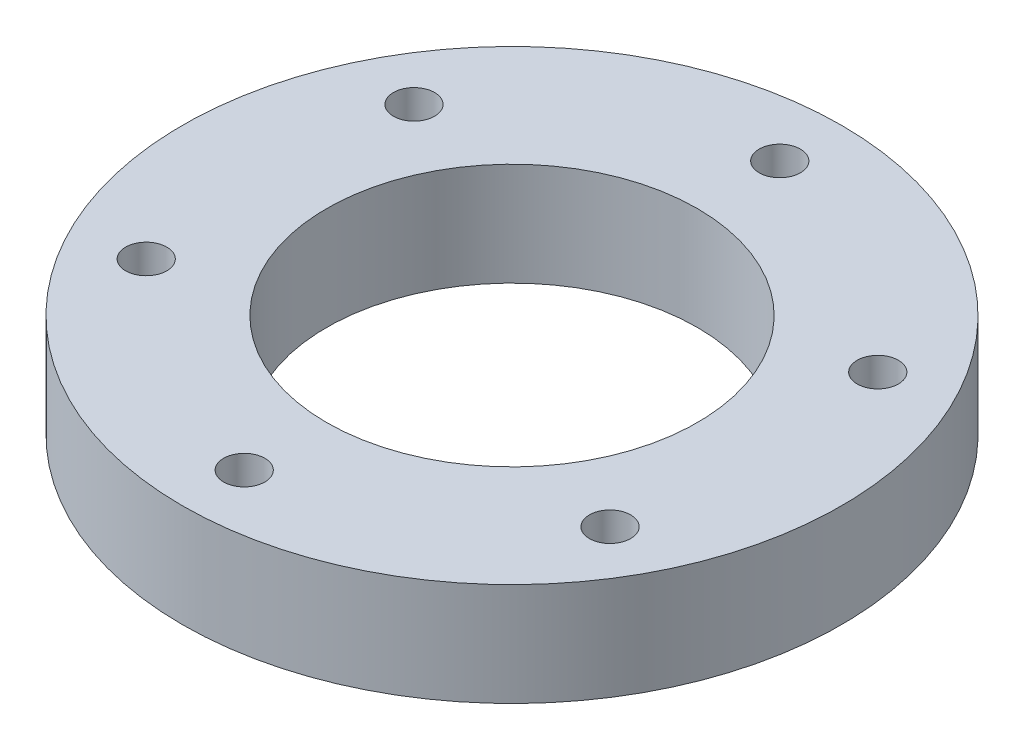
SolidWorks part; units mm, degrees
ref_plane "Front Plane" through (0, 0, 0) normal (0, 0, 1) x (1, 0, 0)
ref_plane "Top Plane" through (0, 0, 0) normal (0, 1, 0) x (1, 0, 0)
ref_plane "Right Plane" through (0, 0, 0) normal (1, 0, 0) x (0, 0, -1)
sketch "Sketch1" plane through (0, 0, 0) normal (0, 1, 0) x (1, 0, 0)
  circle A0 centre (0, 0) radius 11.43
  circle A1 centre (0, 0) radius 20.32
  circle A2 centre (0, 16.51) radius 1.27
  circle A3 centre (14.2981, 8.255) radius 1.27
  circle A4 centre (14.2981, -8.255) radius 1.27
  circle A5 centre (0, -16.51) radius 1.27
  circle A6 centre (-14.2981, -8.255) radius 1.27
  circle A7 centre (-14.2981, 8.255) radius 1.27
  dimension "D1" = 22.86
  dimension "D2" = 40.64
  dimension "D3" = 2.54
  dimension "D4" = 16.51
  dimension "D5" = 6
extrude "Boss-Extrude1" add sketch "Sketch1" along normal mid plane 6.35
